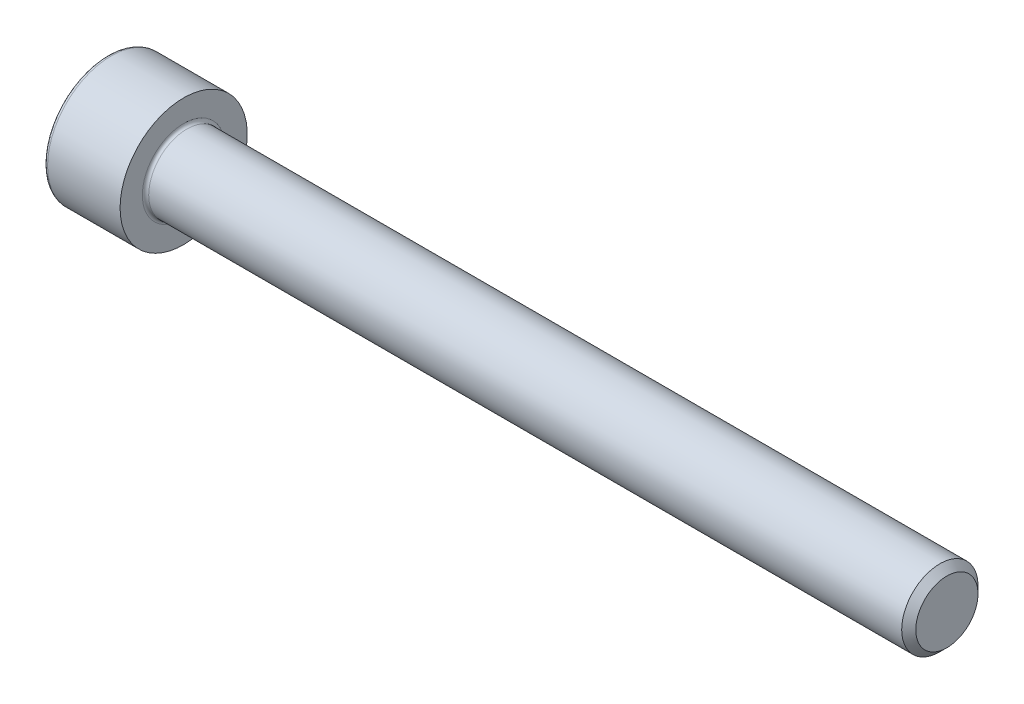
SolidWorks part; units mm, degrees
ref_plane "Plane1" through (0, 0, 0) normal (0, 0, 1) x (1, 0, 0)
ref_plane "Plane2" through (0, 0, 0) normal (0, 1, 0) x (1, 0, 0)
ref_plane "Plane3" through (0, 0, 0) normal (1, 0, 0) x (0, 0, -1)
sketch "BodySke" plane through (0, 0, 0) normal (0, 0, 1) x (1, 0, 0)
  line L0 (0, 0) -> (0, 5)
  line L1 (0, 5) -> (6, 5)
  line L2 (6, 5) -> (6, 3)
  line L3 (6, 3) -> (65.4455, 3)
  line L4 (66, 2.4455) -> (66, 0)
  line L5 (66, 0) -> (0, 0)
  line L6 (-31.75, 0) -> (127, 0) construction
  line L8 (66, 2.4455) -> (65.4455, 3)
  line L10 (66, -2.4455) -> (65.4455, -3) construction
  line L11 (7, 9.525) -> (7, 3.175) construction
  line L12 (42, 9.525) -> (42, 3.175) construction
  line L13 (6, 9.525) -> (6, 3.175) construction
  dimension "Diameter" = 6
  dimension "Head_ht" = 6
  dimension "Length" = 60
  dimension "Body_ch_ang" = 45
  dimension "Head_dia" = 10
  dimension "Minor_dia" = 4.891
  dimension "Advance" = 1
  dimension "Thread_nom" = 24
  dimension "Thread_length" = 60
revolve "Base-Revolve" add sketch "BodySke"
fillet "Fillet1" radius 0.25 1 edges at (6, 0, 3)
fillet "Fillet2" radius 0.3 1 edges at (0, 0, 5)
sketch "Sketch2" plane through (0, 0, 0) normal (0, 0, 1) x (1, 0, 0)
  line L0 (0, 2.542) -> (3, 2.542)
  line L1 (3, 2.542) -> (4.4676, 0)
  line L2 (-31.75, 0) -> (127, 0) construction
  line L3 (4.4676, 0) -> (0, 0)
  line L4 (0, 0) -> (0, 2.542)
  line L6 (0, 0) -> (47.625, 0) construction
  dimension "D1" = 2.542
  dimension "D2" = 60
  dimension "Depth" = 3
revolve "Hex-PreBroach" cut sketch "Sketch2" angle 360 about L6
sketch "Sketch3" plane through (0, 0, 0) normal (-1, 0, 0) x (0, 0.5, 0.866)
  line L0 (1.4676, 2.542) -> (-1.4676, 2.542)
  line L1 (-1.4676, 2.542) -> (-2.9352, 0)
  line L2 (1.4676, 2.542) -> (2.9352, 0)
  line L3 (1.4676, -2.542) -> (2.9352, 0)
  line L4 (1.4676, -2.542) -> (-1.4676, -2.542)
  line L5 (-1.4676, -2.542) -> (-2.9352, 0)
  dimension "D1" = 2.542
  dimension "D2" = 2.542
  dimension "Hex_size" = 5.084
extrude "Hex" cut sketch "Sketch3" against normal blind 3
sketch "ThdSchSke" plane through (0, 0, 0) normal (0, 0, 1) x (1, 0, 0)
  line L0 (42, -2.4455) -> (41.6117, -3)
  line L1 (42, -2.4455) -> (42.3883, -3)
  line L2 (42.3883, -3) -> (42.3883, -3.75)
  line L3 (-3.175, 0) -> (5.1513, 0) construction
  line L4 (0, 4.7) -> (0, -4.7) construction
  line L5 (42.3883, -3.75) -> (41.6117, -3.75)
  line L6 (41.6117, -3.75) -> (41.6117, -3)
  dimension "Thread_minor" = 4.891
  dimension "Diameter" = 6
  dimension "Start" = 42
  dimension "SideAngle" = 55
  dimension "VeeAngle" = 70
  dimension "Overcut" = 7.5
revolve "ThreadSchematic" [suppressed] cut sketch "ThdSchSke" angle 360 about L3
pattern_linear "ThdSchPat" [suppressed]
equation "\"D2@Sketch3\" = \"Hex_size@Sketch3\" / 2"
equation "\"D1@Sketch3\" = \"Hex_size@Sketch3\" / 2"
equation "\"D1@Sketch2\" = \"Hex_size@Sketch3\" / 2"
equation "\"Thread_minor@ThreadCosmetic\"  =  \"Minor_dia@BodySke\""
equation "\"Depth@Sketch2\" =  \"Key_eng@Hex\""
equation "\"Thread_length@ThreadCosmetic\" = ((sgn( (\"Length@BodySke\" - \"Advance@BodySke\" * 3.0) - \"Thread_nom@BodySke\" )-1)*( (\"Length@BodySke\" - \"Advance@BodySke\" * 3.0) - \"Thread_nom@BodySke\" ))/-2+ \"Thread_no"
equation "\"Thread_minor@ThdSchSke\" = \"Minor_dia@BodySke\""
equation "\"Diameter@ThdSchSke\" = \"Diameter@BodySke\""
equation "\"Overcut@ThdSchSke\" = \"Diameter@BodySke\" * 1.25"
equation "\"Start@ThdSchSke\" = \"Head_ht@BodySke\" + \"Length@BodySke\" - \"Thread_length@ThreadCosmetic\"  '---Non-countersunk---"
equation "\"Num_threads@ThdSchPat\" = int( \"Thread_length@ThreadCosmetic\" / \"Advance@BodySke\" + 0.999 )  + 1"
equation "\"Advance@ThdSchPat\" = \"Thread_length@ThreadCosmetic\" /  (\"Num_threads@ThdSchPat\" - 1) 'relax it"
equation "\"Num_threads@ThdSchPat\" = \"Num_threads@ThdSchPat\" - sgn( \"Num_threads@ThdSchPat\" - 1) '---chamfered tips only---"
